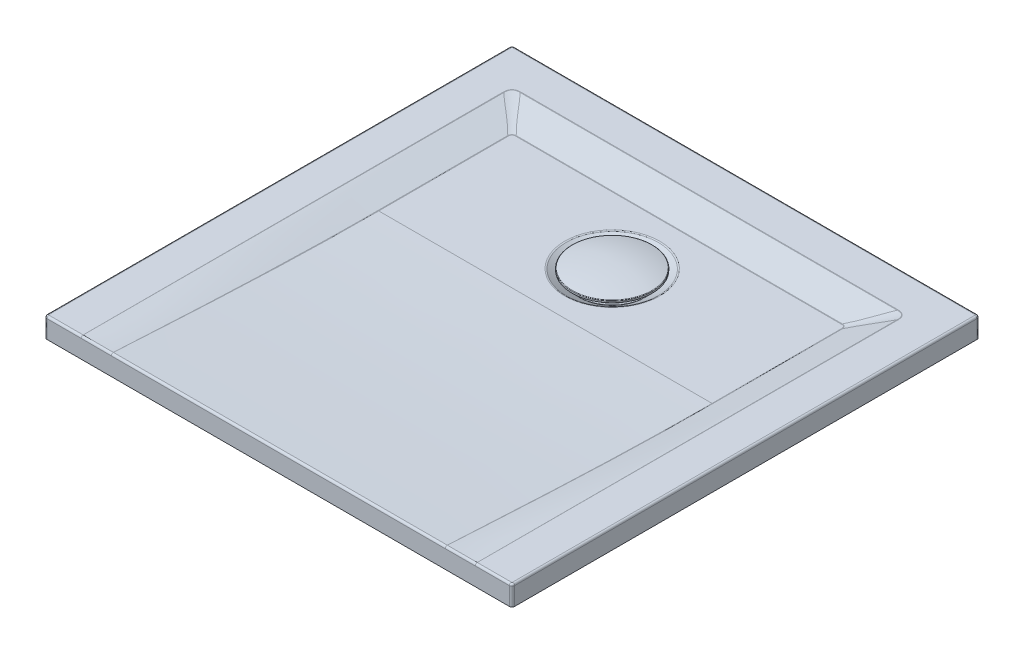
SolidWorks part; units mm, degrees
ref_plane "Płaszczyzna przednia" through (0, 0, 0) normal (0, 0, 1) x (1, 0, 0)
ref_plane "Płaszczyzna górna" through (0, 0, 0) normal (0, 1, 0) x (1, 0, 0)
ref_plane "Płaszczyzna prawa" through (0, 0, 0) normal (1, 0, 0) x (0, 0, -1)
sketch "Szkic1" plane through (0, 0, 0) normal (0, 1, 0) x (1, 0, 0)
  line L0 (0, 350) -> (0, -350) construction
  line L1 (-350, 350) -> (350, 350)
  line L2 (-350, 350) -> (-350, -350)
  line L3 (-350, -350) -> (350, -350)
  line L4 (350, 350) -> (350, -350)
  line L5 (-295, -350) -> (-295, 295)
  line L6 (-295, 295) -> (295, 295)
  line L7 (295, 295) -> (295, -350)
  line L8 (-250, -350) -> (-250, 250)
  line L9 (-250, 250) -> (250, 250)
  line L10 (250, 250) -> (250, -350)
  circle A0 centre (0, 150) radius 45
  circle A1 centre (0, 150) radius 70
  point P9 (0, 295)
  dimension "D6" = 90
  dimension "D7" = 140
  dimension "D1" = 700
  dimension "D2" = 55
  dimension "D3" = 55
  dimension "D5" = 200
  dimension "D8" = 700
  dimension "D4" = 45
sketch "Szkic2" plane through (0, 0, 0) normal (0, 1, 0) x (1, 0, 0)
  line L0 (-350, -350) -> (350, -350) construction
  line L1 (350, 350) -> (350, -350) construction
  line L2 (295, 295) -> (295, -350) construction
  line L3 (-295, 295) -> (295, 295) construction
  line L4 (-350, 350) -> (350, 350) construction
  line L5 (-295, -350) -> (-295, 295) construction
  line L6 (-350, 350) -> (-350, -350) construction
  line L7 (-350, -350) -> (-295, -350)
  line L8 (350, 350) -> (350, -350)
  line L9 (295, 295) -> (295, -350)
  line L10 (-295, 295) -> (295, 295)
  line L11 (-350, 350) -> (350, 350)
  line L12 (-295, -350) -> (-295, 295)
  line L13 (-350, 350) -> (-350, -350)
  line L14 (295, -350) -> (350, -350)
surface "Powierzchnia-Płaszczyzna1" sketch "Szkic2"
ref_plane "Płaszczyzna1" through (0, -15, 0) normal (0, 1, 0) x (-1, 0, 0)
sketch "Szkic3" plane through (0, -15, 0) normal (0, 1, 0) x (-1, 0, 0)
  line L0 (250, -50) -> (-250, -50)
  line L1 (250, 350) -> (250, -250) construction
  line L2 (-250, -250) -> (-250, 350) construction
  line L3 (0, -50) -> (0, -250) construction
  line L4 (250, -250) -> (-250, -250) construction
  line L5 (-250, -250) -> (-250, -50)
  line L6 (250, -50) -> (250, -250)
  line L7 (250, -250) -> (-250, -250)
  circle A0 centre (0, -150) radius 70 construction
  circle A1 centre (0, -150) radius 70
  point P10 (0, -150)
surface "Powierzchnia-Płaszczyzna2" sketch "Szkic3"
sketch "Szkic4" plane through (0, 0, 0) normal (0, 1, 0) x (1, 0, 0)
  line L0 (250, -350) -> (-250, -350)
other "Granica-Powierzchnia1"
other "Granica-Powierzchnia2"
other "Granica-Powierzchnia3"
mirror "Lustro1" about plane through (0, 0, 0) normal (1, 0, 0)
sketch "Szkic5" plane through (0, 0, 0) normal (0, 1, 0) x (1, 0, 0)
  line L0 (350, 350) -> (350, -350) construction
  line L1 (-350, 350) -> (350, 350) construction
  line L2 (-350, 350) -> (-350, -350) construction
  line L3 (-350, -350) -> (350, -350) construction
  line L4 (350, 350) -> (350, -350)
  line L5 (-350, 350) -> (350, 350)
  line L6 (-350, 350) -> (-350, -350)
  line L7 (-350, -350) -> (350, -350)
surface "Powierzchnia-Wyciągnięcie1" sketch "Szkic5" parameters "D1"=30
sketch "Szkic7" plane through (0, 0, 0) normal (1, 0, 0) x (0, 0, -1)
  line L0 (150, 0) -> (150, -30) construction
  line L1 (350, -30) -> (-350, -30) construction
  line L2 (195, -30) -> (195, -28)
  line L3 (195, -28) -> (199, -28)
  line L6 (199, -28) -> (220, -15)
  dimension "D1" = 90
  dimension "D2" = 2
  dimension "D3" = 98
surface "Powierzchnia-Obrót wokół linii środkowej1" sketch "Szkic7" parameters "D1"=360
surface "Powierzchnia-Płaszczyzna3"
surface "Powierzchnia-Połącz1"
fillet "Zaokrąglenie1" radius 4 6 edges at (0, -28, -199) (0, -15, -80) (350, -15, 350) (350, -15, -350) (-350, -15, -350) (-350, -15, 350)
fillet "Zmienne zaokrąglenie1" radius 40 2 edges at (272.5, -7.5, -272.5)
fillet "Zaokrąglenie3" radius 3 12 edges
fillet "Zaokrąglenie4" radius 3 12 edges at (-348.8284, 0, -348.8284) (0, 0, -350) (348.8284, 0, -348.8284) (350, 0, 0) (348.8284, 0, 348.8284) (320.5, 0, 350) (-320.5, 0, 350) (-348.8284, 0, 348.8284) (-350, 0, 0)
sketch "Szkic8" plane through (0, 0, 0) normal (1, 0, 0) x (0, 0, -1)
  line L0 (150, 0) -> (150, -30) construction
  line L1 (150, -5.6601) -> (179.8469, -5.6601) construction
  line L2 (210, -14.7573) -> (210, -17)
  line L3 (210, -17) -> (150, -17)
  line L4 (150, -17) -> (150, -5.6601)
  line L5 (150, -5.6601) -> (199.9922, 95.6514)
  arc A0 (150, -5.6601) -> (209.2694, -13.7943) centre (150, -225.6601) cw
  arc A1 (209.2694, -13.7943) -> (210, -14.7573) centre (209, -14.7573) cw
  point P11 (210, -14)
  dimension "D1" = 220
  dimension "D4" = 1
  dimension "D2" = 60
  dimension "D3" = 3
  dimension "D5" = 13
revolve "Obrót wokół linii środkowej1" add sketch "Szkic8" angle 360 about L4
